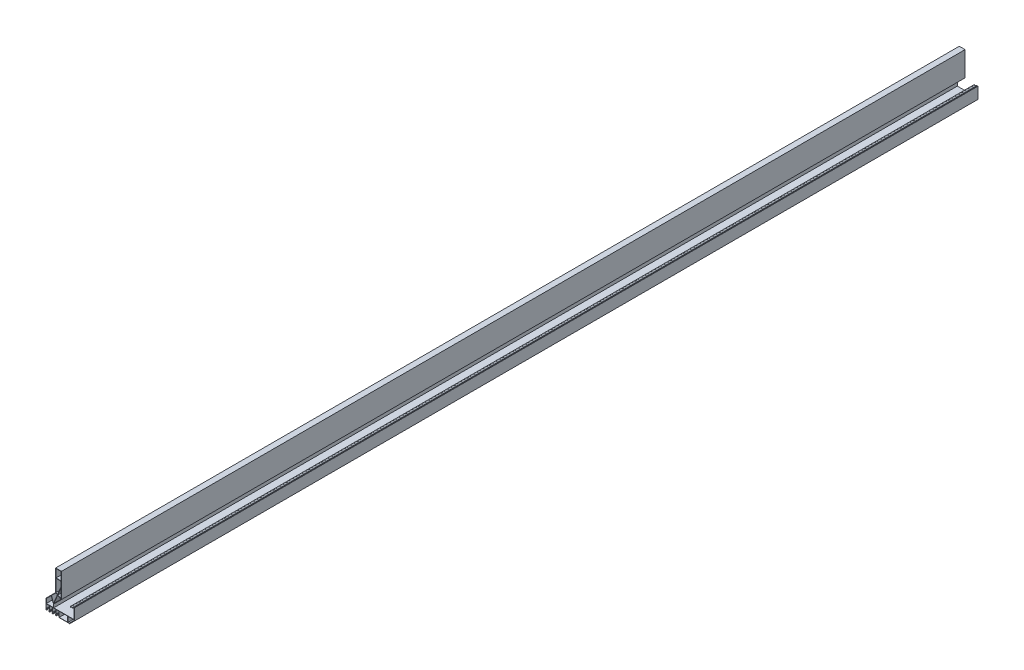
SolidWorks part; units mm, degrees
ref_plane "Plan de face" through (0, 0, 0) normal (0, 0, 1) x (1, 0, 0)
ref_plane "Plan de dessus" through (0, 0, 0) normal (0, 1, 0) x (1, 0, 0)
ref_plane "Plan de droite" through (0, 0, 0) normal (1, 0, 0) x (0, 0, -1)
sketch "Esquisse1" plane through (0, 0, 0) normal (0, 0, 1) x (1, 0, 0)
  line L0 (45, 165) -> (45, -24.4975)
  line L1 (42.5, 162.5) -> (42.5, 99.2051)
  line L2 (42.5, 96.7051) -> (42.5, 61.4228)
  line L3 (42.5, 54.9096) -> (42.5, -22.0289)
  line L4 (0, 0) -> (-75, -75)
  line L5 (1.5818, -1.9538) -> (-33.0691, -36.6047)
  line L6 (-35, -38.5355) -> (-72.5, -76.0355)
  line L7 (45, -24.4975) -> (-15, -84.4975)
  line L8 (41.5818, -24.3802) -> (-13.2525, -79.2144)
  line L9 (0, 0) -> (0, 165)
  line L10 (2.5, 0.3975) -> (2.5, 96.7051)
  line L11 (2.5, 99.2051) -> (2.5, 162.5)
  line L12 (-75, -155) -> (-75, -75)
  line L13 (-72.5, -109.5) -> (-72.5, -76.0355)
  line L14 (0, 165) -> (45, 165)
  line L15 (2.5, 162.5) -> (42.5, 162.5)
  line L16 (24.45, -155) -> (109.0187, -155)
  line L17 (27.6, -153) -> (92.4832, -153)
  line L18 (94.4832, -153.5) -> (107.9832, -153.5)
  line L19 (-15, -110) -> (143, -110)
  line L20 (-73.6, -112) -> (-49.7, -112)
  line L21 (-48.3, -112) -> (-24.4, -112)
  line L22 (-23, -112) -> (0.9, -112)
  line L23 (2.3, -112) -> (26.2, -112)
  line L24 (27.6, -112) -> (92.4832, -112)
  line L25 (94.4832, -112) -> (143, -112)
  line L26 (145, -119.0187) -> (145, -30)
  line L27 (143, -117.9259) -> (143, -112)
  line L28 (143, -110) -> (143, -37)
  line L29 (0.4, -152.7417) -> (0.4, -145.05)
  line L30 (-0.9, -151.6) -> (-0.9, -152.2801)
  line L31 (-1.7, -151.1) -> (-1.4, -151.1)
  line L32 (-1.9, -153.6) -> (-1.9, -151.3)
  line L33 (-1.05, -153.8) -> (-1.7, -153.8)
  line L34 (-1.05, -154.8) -> (-1.05, -153.8)
  line L35 (4.05, -155) -> (-0.85, -155)
  line L36 (2.3, -112) -> (2.3, -143.5)
  line L37 (0.9, -112) -> (0.9, -143.5)
  line L38 (-1.4, -143.8) -> (0.6, -143.8)
  line L39 (-1.9, -146.2) -> (-1.9, -144.3)
  line L40 (-0.9, -145.05) -> (-0.9, -146.2)
  line L41 (0.4, -145.05) -> (-0.9, -145.05)
  line L42 (2.8, -152.7417) -> (2.8, -145.05)
  line L43 (4.1, -151.6) -> (4.1, -152.2801)
  line L44 (4.9, -151.1) -> (4.6, -151.1)
  line L45 (5.1, -153.6) -> (5.1, -151.3)
  line L46 (4.25, -153.8) -> (4.9, -153.8)
  line L47 (4.25, -154.8) -> (4.25, -153.8)
  line L48 (4.6, -143.8) -> (2.6, -143.8)
  line L49 (5.1, -146.2) -> (5.1, -144.3)
  line L50 (4.1, -145.05) -> (4.1, -146.2)
  line L51 (2.8, -145.05) -> (4.1, -145.05)
  line L52 (25.7, -152.7417) -> (25.7, -145.05)
  line L53 (24.4, -151.6) -> (24.4, -152.2801)
  line L54 (23.6, -151.1) -> (23.9, -151.1)
  line L55 (23.4, -153.6) -> (23.4, -151.3)
  line L56 (24.25, -153.8) -> (23.6, -153.8)
  line L57 (24.25, -154.8) -> (24.25, -153.8)
  line L58 (27.6, -112) -> (27.6, -153)
  line L59 (26.2, -112) -> (26.2, -143.5)
  line L60 (23.9, -143.8) -> (25.9, -143.8)
  line L61 (23.4, -146.2) -> (23.4, -144.3)
  line L62 (24.4, -145.05) -> (24.4, -146.2)
  line L63 (25.7, -145.05) -> (24.4, -145.05)
  line L65 (-24.9, -152.7417) -> (-24.9, -145.05)
  line L66 (-26.2, -151.6) -> (-26.2, -152.2801)
  line L67 (-27, -151.1) -> (-26.7, -151.1)
  line L68 (-27.2, -153.6) -> (-27.2, -151.3)
  line L69 (-26.35, -153.8) -> (-27, -153.8)
  line L70 (-26.35, -154.8) -> (-26.35, -153.8)
  line L71 (-21.25, -155) -> (-26.15, -155)
  line L72 (-23, -112) -> (-23, -143.5)
  line L73 (-24.4, -112) -> (-24.4, -143.5)
  line L74 (-26.7, -143.8) -> (-24.7, -143.8)
  line L75 (-27.2, -146.2) -> (-27.2, -144.3)
  line L76 (-26.2, -145.05) -> (-26.2, -146.2)
  line L77 (-24.9, -145.05) -> (-26.2, -145.05)
  line L78 (-22.5, -152.7417) -> (-22.5, -145.05)
  line L79 (-21.2, -151.6) -> (-21.2, -152.2801)
  line L80 (-20.4, -151.1) -> (-20.7, -151.1)
  line L81 (-20.2, -153.6) -> (-20.2, -151.3)
  line L82 (-21.05, -153.8) -> (-20.4, -153.8)
  line L83 (-21.05, -154.8) -> (-21.05, -153.8)
  line L84 (-20.7, -143.8) -> (-22.7, -143.8)
  line L85 (-20.2, -146.2) -> (-20.2, -144.3)
  line L86 (-21.2, -145.05) -> (-21.2, -146.2)
  line L87 (-22.5, -145.05) -> (-21.2, -145.05)
  line L89 (-50.2, -152.7417) -> (-50.2, -145.05)
  line L90 (-51.5, -151.6) -> (-51.5, -152.2801)
  line L91 (-52.3, -151.1) -> (-52, -151.1)
  line L92 (-52.5, -153.6) -> (-52.5, -151.3)
  line L93 (-51.65, -153.8) -> (-52.3, -153.8)
  line L94 (-51.65, -154.8) -> (-51.65, -153.8)
  line L95 (-46.55, -155) -> (-51.45, -155)
  line L96 (-48.3, -112) -> (-48.3, -143.5)
  line L97 (-49.7, -112) -> (-49.7, -143.5)
  line L98 (-52, -143.8) -> (-50, -143.8)
  line L99 (-52.5, -146.2) -> (-52.5, -144.3)
  line L100 (-51.5, -145.05) -> (-51.5, -146.2)
  line L101 (-50.2, -145.05) -> (-51.5, -145.05)
  line L102 (-47.8, -152.7417) -> (-47.8, -145.05)
  line L103 (-46.5, -151.6) -> (-46.5, -152.2801)
  line L104 (-45.7, -151.1) -> (-46, -151.1)
  line L105 (-45.5, -153.6) -> (-45.5, -151.3)
  line L106 (-46.35, -153.8) -> (-45.7, -153.8)
  line L107 (-46.35, -154.8) -> (-46.35, -153.8)
  line L108 (-46, -143.8) -> (-48, -143.8)
  line L109 (-45.5, -146.2) -> (-45.5, -144.3)
  line L110 (-46.5, -145.05) -> (-46.5, -146.2)
  line L111 (-47.8, -145.05) -> (-46.5, -145.05)
  line L112 (-72.5, -109.5) -> (-17.5, -109.5)
  line L113 (-71.85, -155) -> (-75, -155)
  line L114 (-73.6, -112) -> (-73.6, -143.5)
  line L116 (-73.1, -152.7417) -> (-73.1, -145.05)
  line L117 (-71.8, -151.6) -> (-71.8, -152.2801)
  line L118 (-71, -151.1) -> (-71.3, -151.1)
  line L119 (-70.8, -153.6) -> (-70.8, -151.3)
  line L120 (-71.65, -153.8) -> (-71, -153.8)
  line L121 (-71.65, -154.8) -> (-71.65, -153.8)
  line L122 (-71.3, -143.8) -> (-73.3, -143.8)
  line L123 (-70.8, -146.2) -> (-70.8, -144.3)
  line L124 (-71.8, -145.05) -> (-71.8, -146.2)
  line L125 (-73.1, -145.05) -> (-71.8, -145.05)
  line L126 (135.6, -30) -> (137.3268, -30)
  line L127 (137.3268, -30) -> (137.7598, -30.75)
  line L128 (137.5, -31.2) -> (137, -31.2)
  line L129 (137, -31.2) -> (137, -35)
  line L130 (137, -35) -> (143.7, -35)
  line L131 (116.3, -37) -> (127.6, -37)
  line L132 (129.1, -37) -> (143, -37)
  line L133 (143.7, -35) -> (143.7, -31.2)
  line L134 (143.7, -31.2) -> (143.5, -31.2)
  line L135 (143.2402, -30.75) -> (143.6732, -30)
  line L136 (143.6732, -30) -> (145, -30)
  line L137 (145, -30) -> (145, -35)
  line L138 (135.6, -30) -> (135.6, -35)
  line L139 (122.4, -35) -> (135.6, -35)
  line L140 (122.1, -35.3) -> (122.4, -35)
  line L141 (121.8, -35.3) -> (122.1, -35.3)
  line L142 (121.5, -35) -> (121.8, -35.3)
  line L143 (115, -35) -> (121.5, -35)
  line L144 (115, -40.5) -> (115, -35)
  line L145 (116.3, -41.5) -> (116, -41.5)
  line L146 (116.3, -37) -> (116.3, -41.5)
  line L147 (127.6, -39.5) -> (127.6, -37)
  line L148 (128.1, -39.5) -> (127.6, -39.5)
  line L149 (129.1, -37) -> (129.1, -38.5)
  line L150 (92.4832, -153) -> (92.4832, -112)
  line L151 (94.4832, -153.5) -> (94.4832, -112)
  line L152 (110.2874, -152.3171) -> (110.8531, -152.8828)
  line L153 (110.4815, -151.8402) -> (110.2874, -152.0343)
  line L154 (109.0187, -155) -> (110.8531, -153.1657)
  line L155 (110.8264, -149.4743) -> (110.2837, -148.4712)
  line L156 (109.8607, -148.3596) -> (109.1882, -148.7804)
  line L157 (109.0835, -149.1774) -> (109.4096, -149.7803)
  line L158 (108.6903, -153.2071) -> (108.8367, -153.0607)
  line L159 (138.9908, -119.2701) -> (139.5937, -119.5962)
  line L160 (138.173, -120.0473) -> (138.5938, -119.3748)
  line L161 (139.2878, -121.013) -> (138.2846, -120.4703)
  line L162 (141.6536, -120.6681) -> (141.8477, -120.474)
  line L163 (142.1306, -120.474) -> (142.6962, -121.0397)
  line L164 (142.9791, -121.0397) -> (145, -119.0187)
  line L166 (-15, -110) -> (-15, -84.4975)
  line L167 (-17.5, -109.5) -> (-17.5, -83.4619)
  line L168 (-17.5, -83.4619) -> (-35, -38.5355)
  line L169 (-16.224, -79.8499) -> (-33.0691, -36.6047)
  line L170 (-16.224, -79.8499) -> (13.4012, -8.5804)
  line L171 (14.3674, -6.256) -> (42.5, 61.4228)
  line L172 (-13.2525, -79.2144) -> (15.5968, -9.8115)
  line L173 (16.563, -7.4871) -> (42.5, 54.9096)
  line L174 (42.5, -22.0289) -> (16.563, -7.4871)
  line L175 (14.3674, -6.256) -> (2.5, 0.3975)
  line L176 (41.5818, -24.3802) -> (15.5968, -9.8115)
  line L177 (13.4012, -8.5804) -> (1.5818, -1.9538)
  line L178 (2.5, 96.7051) -> (42.5, 96.7051)
  line L179 (2.5, 99.2051) -> (42.5, 99.2051)
  arc A0 (-0.125, -152.9401) -> (0.4, -152.7417) centre (0.1, -152.7417) ccw
  arc A1 (-0.125, -152.9401) -> (-0.6938, -152.5651) centre (-1.1, -153.8) ccw
  arc A2 (-0.9, -152.2801) -> (-0.6938, -152.5651) centre (-0.6, -152.2801) ccw
  arc A3 (-0.9, -151.6) -> (-1.4, -151.1) centre (-1.4, -151.6) ccw
  arc A4 (-1.7, -151.1) -> (-1.9, -151.3) centre (-1.7, -151.3) ccw
  arc A5 (-1.9, -153.6) -> (-1.7, -153.8) centre (-1.7, -153.6) ccw
  arc A6 (-1.05, -154.8) -> (-0.85, -155) centre (-0.85, -154.8) ccw
  arc A7 (0.6, -143.8) -> (0.9, -143.5) centre (0.6, -143.5) ccw
  arc A8 (-1.4, -143.8) -> (-1.9, -144.3) centre (-1.4, -144.3) ccw
  arc A9 (-1.9, -146.2) -> (-0.9, -146.2) centre (-1.4, -146.2) ccw
  arc A10 (2.8, -152.7417) -> (3.325, -152.9401) centre (3.1, -152.7417) ccw
  arc A11 (3.8938, -152.5651) -> (3.325, -152.9401) centre (4.3, -153.8) ccw
  arc A12 (3.8938, -152.5651) -> (4.1, -152.2801) centre (3.8, -152.2801) ccw
  arc A13 (4.6, -151.1) -> (4.1, -151.6) centre (4.6, -151.6) ccw
  arc A14 (5.1, -151.3) -> (4.9, -151.1) centre (4.9, -151.3) ccw
  arc A15 (4.9, -153.8) -> (5.1, -153.6) centre (4.9, -153.6) ccw
  arc A16 (4.05, -155) -> (4.25, -154.8) centre (4.05, -154.8) ccw
  arc A17 (2.3, -143.5) -> (2.6, -143.8) centre (2.6, -143.5) ccw
  arc A18 (5.1, -144.3) -> (4.6, -143.8) centre (4.6, -144.3) ccw
  arc A19 (4.1, -146.2) -> (5.1, -146.2) centre (4.6, -146.2) ccw
  arc A20 (25.175, -152.9401) -> (25.7, -152.7417) centre (25.4, -152.7417) ccw
  arc A21 (25.175, -152.9401) -> (24.6062, -152.5651) centre (24.2, -153.8) ccw
  arc A22 (24.4, -152.2801) -> (24.6062, -152.5651) centre (24.7, -152.2801) ccw
  arc A23 (24.4, -151.6) -> (23.9, -151.1) centre (23.9, -151.6) ccw
  arc A24 (23.6, -151.1) -> (23.4, -151.3) centre (23.6, -151.3) ccw
  arc A25 (23.4, -153.6) -> (23.6, -153.8) centre (23.6, -153.6) ccw
  arc A26 (24.25, -154.8) -> (24.45, -155) centre (24.45, -154.8) ccw
  arc A27 (25.9, -143.8) -> (26.2, -143.5) centre (25.9, -143.5) ccw
  arc A28 (23.9, -143.8) -> (23.4, -144.3) centre (23.9, -144.3) ccw
  arc A29 (23.4, -146.2) -> (24.4, -146.2) centre (23.9, -146.2) ccw
  arc A30 (-25.425, -152.9401) -> (-24.9, -152.7417) centre (-25.2, -152.7417) ccw
  arc A31 (-25.425, -152.9401) -> (-25.9938, -152.5651) centre (-26.4, -153.8) ccw
  arc A32 (-26.2, -152.2801) -> (-25.9938, -152.5651) centre (-25.9, -152.2801) ccw
  arc A33 (-26.2, -151.6) -> (-26.7, -151.1) centre (-26.7, -151.6) ccw
  arc A34 (-27, -151.1) -> (-27.2, -151.3) centre (-27, -151.3) ccw
  arc A35 (-27.2, -153.6) -> (-27, -153.8) centre (-27, -153.6) ccw
  arc A36 (-26.35, -154.8) -> (-26.15, -155) centre (-26.15, -154.8) ccw
  arc A37 (-24.7, -143.8) -> (-24.4, -143.5) centre (-24.7, -143.5) ccw
  arc A38 (-26.7, -143.8) -> (-27.2, -144.3) centre (-26.7, -144.3) ccw
  arc A39 (-27.2, -146.2) -> (-26.2, -146.2) centre (-26.7, -146.2) ccw
  arc A40 (-22.5, -152.7417) -> (-21.975, -152.9401) centre (-22.2, -152.7417) ccw
  arc A41 (-21.4062, -152.5651) -> (-21.975, -152.9401) centre (-21, -153.8) ccw
  arc A42 (-21.4062, -152.5651) -> (-21.2, -152.2801) centre (-21.5, -152.2801) ccw
  arc A43 (-20.7, -151.1) -> (-21.2, -151.6) centre (-20.7, -151.6) ccw
  arc A44 (-20.2, -151.3) -> (-20.4, -151.1) centre (-20.4, -151.3) ccw
  arc A45 (-20.4, -153.8) -> (-20.2, -153.6) centre (-20.4, -153.6) ccw
  arc A46 (-21.25, -155) -> (-21.05, -154.8) centre (-21.25, -154.8) ccw
  arc A47 (-23, -143.5) -> (-22.7, -143.8) centre (-22.7, -143.5) ccw
  arc A48 (-20.2, -144.3) -> (-20.7, -143.8) centre (-20.7, -144.3) ccw
  arc A49 (-21.2, -146.2) -> (-20.2, -146.2) centre (-20.7, -146.2) ccw
  arc A50 (-50.725, -152.9401) -> (-50.2, -152.7417) centre (-50.5, -152.7417) ccw
  arc A51 (-50.725, -152.9401) -> (-51.2938, -152.5651) centre (-51.7, -153.8) ccw
  arc A52 (-51.5, -152.2801) -> (-51.2938, -152.5651) centre (-51.2, -152.2801) ccw
  arc A53 (-51.5, -151.6) -> (-52, -151.1) centre (-52, -151.6) ccw
  arc A54 (-52.3, -151.1) -> (-52.5, -151.3) centre (-52.3, -151.3) ccw
  arc A55 (-52.5, -153.6) -> (-52.3, -153.8) centre (-52.3, -153.6) ccw
  arc A56 (-51.65, -154.8) -> (-51.45, -155) centre (-51.45, -154.8) ccw
  arc A57 (-50, -143.8) -> (-49.7, -143.5) centre (-50, -143.5) ccw
  arc A58 (-52, -143.8) -> (-52.5, -144.3) centre (-52, -144.3) ccw
  arc A59 (-52.5, -146.2) -> (-51.5, -146.2) centre (-52, -146.2) ccw
  arc A60 (-47.8, -152.7417) -> (-47.275, -152.9401) centre (-47.5, -152.7417) ccw
  arc A61 (-46.7062, -152.5651) -> (-47.275, -152.9401) centre (-46.3, -153.8) ccw
  arc A62 (-46.7062, -152.5651) -> (-46.5, -152.2801) centre (-46.8, -152.2801) ccw
  arc A63 (-46, -151.1) -> (-46.5, -151.6) centre (-46, -151.6) ccw
  arc A64 (-45.5, -151.3) -> (-45.7, -151.1) centre (-45.7, -151.3) ccw
  arc A65 (-45.7, -153.8) -> (-45.5, -153.6) centre (-45.7, -153.6) ccw
  arc A66 (-46.55, -155) -> (-46.35, -154.8) centre (-46.55, -154.8) ccw
  arc A67 (-48.3, -143.5) -> (-48, -143.8) centre (-48, -143.5) ccw
  arc A68 (-45.5, -144.3) -> (-46, -143.8) centre (-46, -144.3) ccw
  arc A69 (-46.5, -146.2) -> (-45.5, -146.2) centre (-46, -146.2) ccw
  arc A70 (-73.1, -152.7417) -> (-72.575, -152.9401) centre (-72.8, -152.7417) ccw
  arc A71 (-72.0062, -152.5651) -> (-72.575, -152.9401) centre (-71.6, -153.8) ccw
  arc A72 (-72.0062, -152.5651) -> (-71.8, -152.2801) centre (-72.1, -152.2801) ccw
  arc A73 (-71.3, -151.1) -> (-71.8, -151.6) centre (-71.3, -151.6) ccw
  arc A74 (-70.8, -151.3) -> (-71, -151.1) centre (-71, -151.3) ccw
  arc A75 (-71, -153.8) -> (-70.8, -153.6) centre (-71, -153.6) ccw
  arc A76 (-71.85, -155) -> (-71.65, -154.8) centre (-71.85, -154.8) ccw
  arc A77 (-73.6, -143.5) -> (-73.3, -143.8) centre (-73.3, -143.5) ccw
  arc A78 (-70.8, -144.3) -> (-71.3, -143.8) centre (-71.3, -144.3) ccw
  arc A79 (-71.8, -146.2) -> (-70.8, -146.2) centre (-71.3, -146.2) ccw
  arc A80 (137.5, -31.2) -> (137.7598, -30.75) centre (137.5, -30.9) ccw
  arc A81 (143.2402, -30.75) -> (143.5, -31.2) centre (143.5, -30.9) ccw
  arc A82 (115, -40.5) -> (116, -41.5) centre (116, -40.5) ccw
  arc A83 (128.1, -39.5) -> (129.1, -38.5) centre (128.1, -38.5) ccw
  arc A84 (110.2874, -152.0343) -> (110.2874, -152.3171) centre (110.4288, -152.1757) ccw
  arc A85 (110.8531, -153.1657) -> (110.8531, -152.8828) centre (110.7117, -153.0242) ccw
  arc A86 (110.4815, -151.8402) -> (110.8264, -149.4743) centre (109.0673, -150.426) ccw
  arc A87 (110.2837, -148.4712) -> (109.8607, -148.3596) centre (110.0198, -148.6139) ccw
  arc A88 (109.1882, -148.7804) -> (109.0835, -149.1774) centre (109.3474, -149.0347) ccw
  arc A89 (109.2372, -150.9632) -> (109.4096, -149.7803) centre (108.5301, -150.2561) ccw
  arc A90 (109.2372, -150.9632) -> (108.8789, -152.8399) centre (110.4393, -152.1653) ccw
  arc A91 (108.8367, -153.0607) -> (108.8789, -152.8399) centre (108.6953, -152.9193) ccw
  arc A92 (107.9832, -153.5) -> (108.6903, -153.2071) centre (107.9832, -152.5) ccw
  arc A93 (141.9921, -118.9259) -> (140.7766, -119.4237) centre (141.9787, -120.6258) ccw
  arc A94 (141.9921, -118.9259) -> (143, -117.9259) centre (142, -117.9259) ccw
  arc A95 (139.5937, -119.5962) -> (140.7766, -119.4237) centre (140.0695, -118.7166) ccw
  arc A96 (138.9908, -119.2701) -> (138.5938, -119.3748) centre (138.8481, -119.5339) ccw
  arc A97 (138.173, -120.0473) -> (138.2846, -120.4703) centre (138.4273, -120.2064) ccw
  arc A98 (139.2878, -121.013) -> (141.6536, -120.6681) centre (140.2394, -119.2539) ccw
  arc A99 (142.1306, -120.474) -> (141.8477, -120.474) centre (141.9891, -120.6154) ccw
  arc A100 (142.6962, -121.0397) -> (142.9791, -121.0397) centre (142.8377, -120.8982) ccw
extrude "Boss.-Extru.1" add sketch "Esquisse1" along normal blind 7000 contours L163 A100 L164 L26 L136 L135 A81 L134 L133 L130 L129 L128 A80 L127 L126 L138 L139 L140 L141 L142 L143 L144 A82 L145 L146 L131 L147 L148 A83 L149 L132 L28 L19 L166 L7 L0 L14 L9 L4 L12 L113 A76 L121 L120 A75 L119 A74 L118 A73 L117
